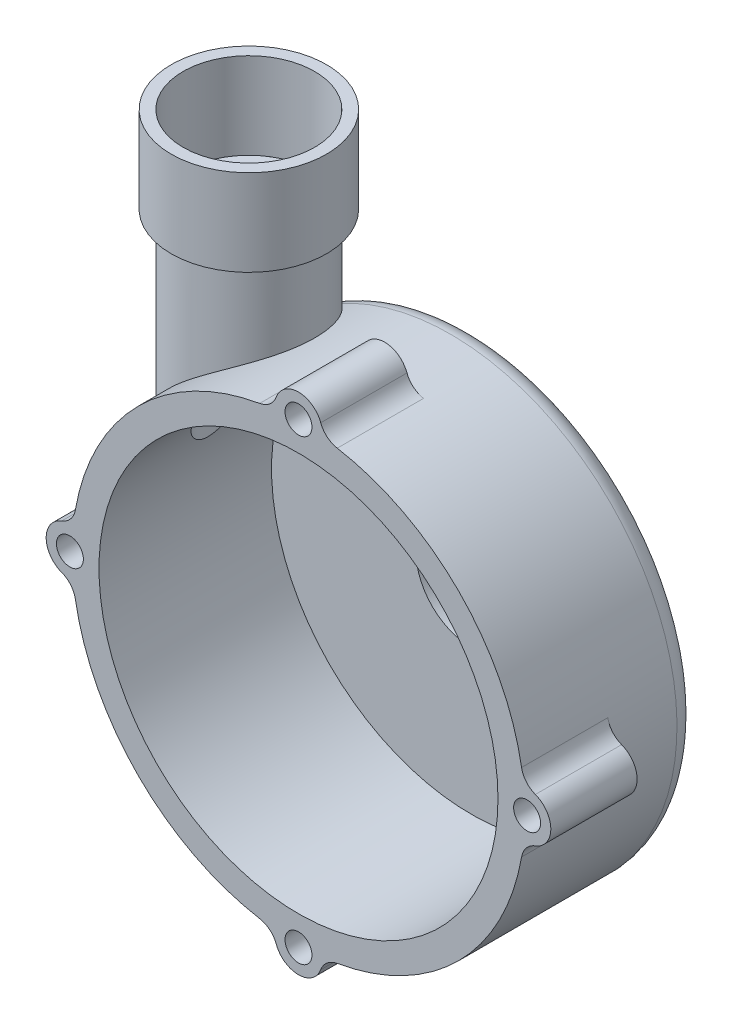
SolidWorks part; units mm, degrees
ref_plane "Alzado" through (0, 0, 0) normal (0, 0, 1) x (1, 0, 0)
ref_plane "Planta" through (0, 0, 0) normal (0, 1, 0) x (1, 0, 0)
ref_plane "Vista lateral" through (0, 0, 0) normal (1, 0, 0) x (0, 0, -1)
sketch "Croquis1" plane through (0, 0, 0) normal (0, 0, 1) x (1, 0, 0)
  circle A0 centre (0, 0) radius 105
  dimension "D1" = 210
extrude "Saliente-Extruir1" add sketch "Croquis1" along normal blind 82
sketch "Croquis2" plane through (0, 0, 0) normal (0, 1, 0) x (1, 0, 0)
  circle A0 centre (-67, -38) radius 19
  circle A1 centre (-67, -38) radius 30.5
  dimension "D1" = 38
  dimension "D4" = 61
  dimension "D2" = 38
  dimension "D3" = 38
extrude "Saliente-Extruir2" add sketch "Croquis2" along normal blind 135
sketch "Croquis3" plane through (0, 0, 0) normal (0, 1, 0) x (1, 0, 0)
  circle A0 centre (-67, -38) radius 19
  dimension "D3" = 38
  dimension "D1" = 38
  dimension "D2" = 38
extrude "Cortar-Extruir1" cut sketch "Croquis3" along normal blind 100
sketch "Croquis4" plane through (0, 0, 0) normal (0, 0, -1) x (-1, 0, 0)
  circle A0 centre (0, 0) radius 25.5
  circle A1 centre (0, 0) radius 30.5
  dimension "D1" = 51
  dimension "D2" = 61
extrude "Saliente-Extruir3" add sketch "Croquis4" along normal blind 40
sketch "Croquis5" plane through (0, 0, 0) normal (1, 0, 0) x (0, 0, -1)
  line L0 (0, 0) -> (31.9303, 0) construction
  line L1 (0, 30.5) -> (8, 30.5)
  line L2 (40, 30.5) -> (0, 30.5) construction
  line L3 (0, 30.5) -> (0, 40.5)
  line L4 (0, -105) -> (0, 105) construction
  spline S0 degree 2 poles (0, 40.5) (2.9077, 33.7499) (8, 30.5) knots 0 0 0 0.485736 0.485736 0.485736
  dimension "D1" = 8
  dimension "D2" = 10
revolve "Revolución1" add sketch "Croquis5" angle 360 about L0
sketch "Croquis6" plane through (0, 0, 0) normal (1, 0, 0) x (0, 0, -1)
  line L0 (0, 0) -> (32.6021, 0) construction
  line L2 (0, -105) -> (0, 105) construction
  line L5 (-1.5, 73.8959) -> (-1.5, 105)
  line L6 (-1.5, 105) -> (0, 105)
  line L7 (0, 105) -> (0, 70.5)
  spline S0 degree 2 poles (0, 70.5) (-0.9657, 72.2097) (-1.5, 73.8959) knots 0 0 0 0.128313 0.128313 0.128313
  dimension "D1" = 1.5
  dimension "D2" = 70.5
revolve "Cortar-Revolución1" cut sketch "Croquis6" angle 360 about L0
sketch "Croquis8" plane through (0, 0, 82) normal (0, 0, 1) x (1, 0, 0)
  circle A0 centre (0, 0) radius 92.5
  dimension "D1" = 185
extrude "Cortar-Extruir2" cut sketch "Croquis8" against normal blind 80
sketch "Croquis10" plane through (0, 0, 82) normal (0, 0, 1) x (1, 0, 0)
  circle A0 centre (0, 106) radius 11
  circle A1 centre (106, 0) radius 11
  circle A2 centre (0, -106) radius 11
  circle A3 centre (-106, 0) radius 11
  dimension "D1" = 22
  dimension "D2" = 106
  dimension "D3" = 4
extrude "Saliente-Extruir4" add sketch "Croquis10" against normal blind 40
sketch "Croquis11" plane through (0, 0, 82) normal (0, 0, 1) x (1, 0, 0)
  circle A0 centre (0, 106) radius 6.25
  circle A1 centre (106, 0) radius 6.25
  circle A2 centre (0, -106) radius 6.25
  circle A3 centre (-106, 0) radius 6.25
  dimension "D1" = 12.5
  dimension "D2" = 4
extrude "Cortar-Extruir3" cut sketch "Croquis11" against normal blind 30
fillet "Redondeo1" radius 10 1 edges at (105, 0, 1.5)
sketch "Croquis12" plane through (0, 135, 0) normal (0, 1, 0) x (1, 0, 0)
  circle A0 centre (-67, -38) radius 30.5
  circle A1 centre (-67, -38) radius 36
  dimension "D1" = 61
  dimension "D2" = 72
extrude "Saliente-Extruir5" add sketch "Croquis12" along normal blind 40 separate body
sketch "Croquis13" plane through (0, 0, 0) normal (0, 0, -1) x (-1, 0, 0)
  circle A0 centre (0, 0) radius 25.5
  dimension "D1" = 51
extrude "Cortar-Extruir4" cut sketch "Croquis13" against normal up to next
fillet "Redondeo2" radius 10 8 edges at (104.434, 10.888, 62) (104.434, -10.888, 62) (10.888, -104.434, 62) (-10.888, -104.434, 62) (-104.434, 10.888, 62) (-104.434, -10.888, 62) (-10.888, 104.434, 62) (10.888, 104.434, 62)
